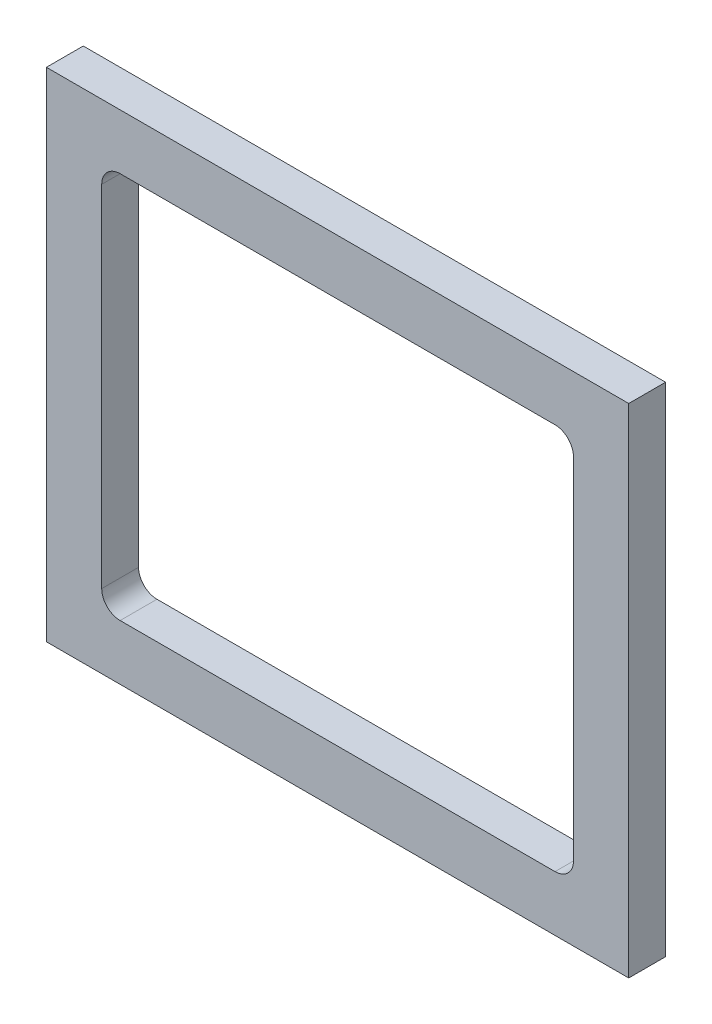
SolidWorks part; units mm, degrees
ref_plane "Plan de face" through (0, 0, 0) normal (0, 0, 1) x (1, 0, 0)
ref_plane "Plan de dessus" through (0, 0, 0) normal (0, 1, 0) x (1, 0, 0)
ref_plane "Plan de droite" through (0, 0, 0) normal (1, 0, 0) x (0, 0, -1)
sketch "Esquisse1" plane through (0, 0, 0) normal (0, 0, 1) x (1, 0, 0)
  line L1 (-63.7061, 49.4623) -> (94.2939, 49.4623)
  line L2 (-63.7061, 49.4623) -> (-63.7061, -85.5377)
  line L3 (-63.7061, -85.5377) -> (94.2939, -85.5377)
  line L4 (94.2939, 49.4623) -> (94.2939, -85.5377)
  line L5 (-43.7061, 34.4623) -> (74.2939, 34.4623)
  line L6 (-48.7061, 29.4623) -> (-48.7061, -65.5377)
  line L7 (-43.7061, -70.5377) -> (74.2939, -70.5377)
  line L8 (79.2939, 29.4623) -> (79.2939, -65.5377)
  arc A0 (-43.7061, 34.4623) -> (-48.7061, 29.4623) centre (-43.7061, 29.4623) ccw
  arc A1 (79.2939, 29.4623) -> (74.2939, 34.4623) centre (74.2939, 29.4623) ccw
  arc A2 (74.2939, -70.5377) -> (79.2939, -65.5377) centre (74.2939, -65.5377) ccw
  arc A3 (-48.7061, -65.5377) -> (-43.7061, -70.5377) centre (-43.7061, -65.5377) ccw
  dimension "D7" = 5
  dimension "D8" = 5
  dimension "D9" = 5
  dimension "D10" = 5
  dimension "D1" = 158
  dimension "D2" = 135
  dimension "D3" = 15
  dimension "D4" = 15
  dimension "D5" = 15
  dimension "D6" = 15
extrude "Boss.-Extru.2" add sketch "Esquisse1" along normal blind 10
